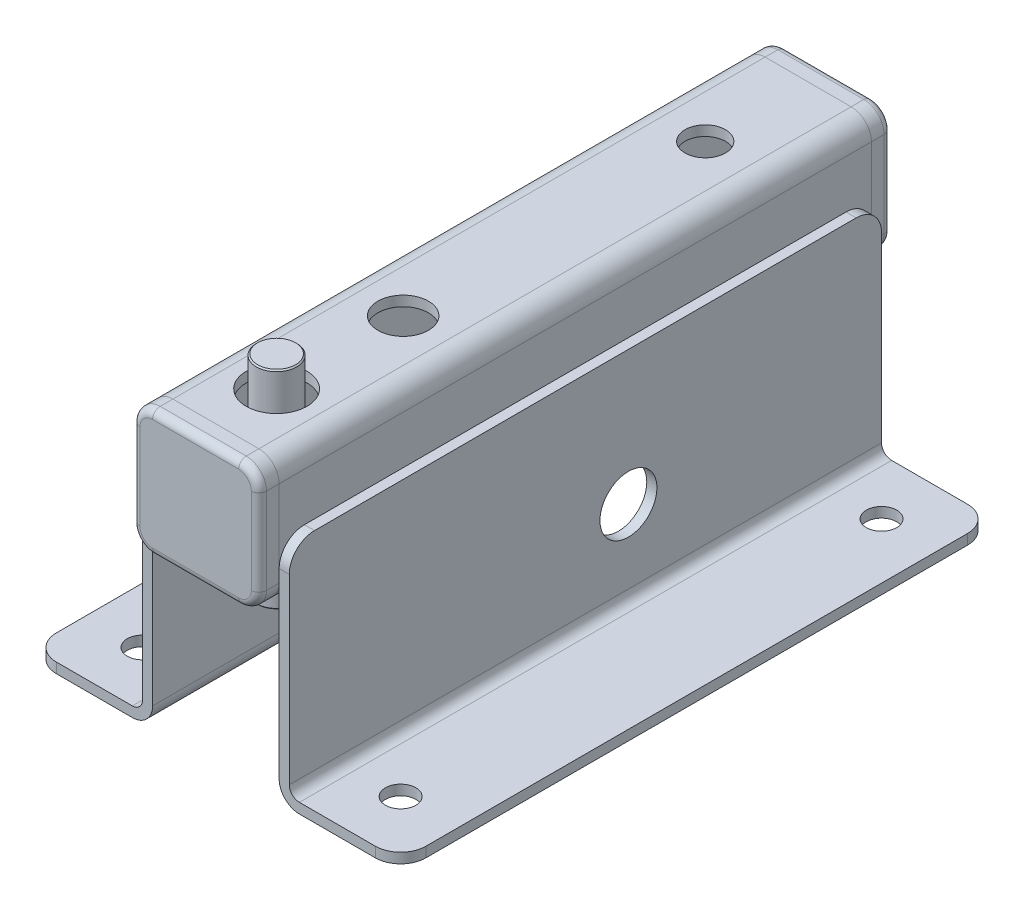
SolidWorks part; units mm, degrees
ref_plane "Plan de face" through (0, 0, 0) normal (0, 0, 1) x (1, 0, 0)
ref_plane "Plan de dessus" through (0, 0, 0) normal (0, 1, 0) x (1, 0, 0)
ref_plane "Plan de droite" through (0, 0, 0) normal (1, 0, 0) x (0, 0, -1)
sketch "Esquisse1" plane through (0, 0, 0) normal (0, 0, 1) x (1, 0, 0)
  line L0 (0, 12.5) -> (0, 0) construction
  line L1 (-8.5, 12.5) -> (8.5, 12.5)
  line L2 (-12.5, 8.5) -> (-12.5, -8.5)
  line L3 (-8.5, -12.5) -> (8.5, -12.5)
  line L4 (12.5, 8.5) -> (12.5, -8.5)
  line L5 (0, 0) -> (12.5, 0) construction
  line L6 (-8.5, 10.5) -> (8.5, 10.5)
  line L7 (10.5, 8.5) -> (10.5, -8.5)
  line L8 (-8.5, -10.5) -> (8.5, -10.5)
  line L9 (-10.5, 8.5) -> (-10.5, -8.5)
  arc A0 (-8.5, 12.5) -> (-12.5, 8.5) centre (-8.5, 8.5) ccw
  arc A1 (-12.5, -8.5) -> (-8.5, -12.5) centre (-8.5, -8.5) ccw
  arc A2 (8.5, -12.5) -> (12.5, -8.5) centre (8.5, -8.5) ccw
  arc A3 (8.5, 12.5) -> (12.5, 8.5) centre (8.5, 8.5) cw
  arc A4 (8.5, 10.5) -> (10.5, 8.5) centre (8.5, 8.5) cw
  arc A5 (8.5, -10.5) -> (10.5, -8.5) centre (8.5, -8.5) ccw
  arc A6 (-10.5, -8.5) -> (-8.5, -10.5) centre (-8.5, -8.5) ccw
  arc A7 (-8.5, 10.5) -> (-10.5, 8.5) centre (-8.5, 8.5) ccw
  dimension "D1" = 4
  dimension "D2" = 25
  dimension "D3" = 2
extrude "Boss.-Extru.1" add sketch "Esquisse1" against normal blind 117
sketch "Esquisse2" plane through (0, 0, 0) normal (0, 0, 1) x (1, 0, 0)
  line L0 (12.5, -1) -> (14.5, -1)
  line L1 (12.5, -8.5) -> (12.5, 8.5) construction
  line L2 (14.5, -1) -> (14.5, -42)
  line L3 (16.5, -44) -> (36.5, -44)
  line L4 (36.5, -44) -> (36.5, -46)
  line L5 (36.5, -46) -> (16.5, -46)
  line L6 (12.5, -42) -> (12.5, -1)
  line L7 (-8.5, -12.5) -> (8.5, -12.5) construction
  line L8 (0, 0) -> (0, -19.0193) construction
  line L9 (-12.5, -42) -> (-12.5, -1)
  line L10 (-36.5, -46) -> (-16.5, -46)
  line L11 (-36.5, -44) -> (-36.5, -46)
  line L12 (-16.5, -44) -> (-36.5, -44)
  line L13 (-14.5, -1) -> (-14.5, -42)
  line L14 (-12.5, -1) -> (-14.5, -1)
  arc A0 (16.5, -46) -> (12.5, -42) centre (16.5, -42) cw
  arc A1 (14.5, -42) -> (16.5, -44) centre (16.5, -42) ccw
  arc A2 (-14.5, -42) -> (-16.5, -44) centre (-16.5, -42) cw
  arc A3 (-16.5, -46) -> (-12.5, -42) centre (-16.5, -42) ccw
  dimension "D1" = 4
  dimension "D2" = 2
  dimension "D3" = 24
  dimension "D4" = 45
  dimension "D5" = 33.5
extrude "Boss.-Extru.2" add sketch "Esquisse2" against normal up to vertex (117 mm away) separate body
sketch "Esquisse3" plane through (0, 12.5, 0) normal (0, 1, 0) x (1, 0, 0)
  line L0 (8.5, 0) -> (-8.5, 0) construction
  line L1 (0, 12) -> (0, 0) construction
  circle A0 centre (0, 12) radius 6
  dimension "D1" = 12
  dimension "D2" = 12
extrude "Enlèv. mat.-Extru.1" cut sketch "Esquisse3" against normal blind 25
sketch "Esquisse6" plane through (0, 0, 0) normal (1, 0, 0) x (0, 0, -1)
  line L1 (18, 12.5) -> (6, 12.5) construction
  line L3 (12, 12.5) -> (12, -50.0553) construction
  line L4 (12, -8.5) -> (8.825, -10.3331)
  line L5 (8.825, -10.3331) -> (8.825, -22.25)
  line L6 (8.575, -22.5) -> (8.25, -22.5)
  line L7 (8, 18.25) -> (8, -22.25)
  line L8 (8.25, 18.5) -> (12, 18.5)
  line L9 (8, 18.25) -> (8.25, 18.5)
  line L10 (8.25, -22.5) -> (8, -22.25)
  line L11 (12, 18.5) -> (12, -8.5)
  line L12 (8.825, -22.25) -> (8.575, -22.5)
  line L14 (117, 12.5) -> (0, 12.5) construction
  point P6 (8, -22.5)
  point P9 (8.825, -22.5)
  point P10 (8, 18.5)
  dimension "D1" = 4
  dimension "D2" = 3.175
  dimension "D9" = 6
  dimension "D3" = 60
  dimension "D4" = 14
  dimension "D5" = 22.5
revolve "Révolution2" add sketch "Esquisse6" angle 360 about L11
sketch "Esquisse8" plane through (0, 12.5, 0) normal (0, 1, 0) x (1, 0, 0)
  line L0 (0, -18) -> (31.5768, -46.4319) construction
  line L1 (9, -53) -> (0, -53) construction
  line L2 (0, 12) -> (0, -18) construction
  line L3 (0, -18) -> (0, -53) construction
  line L4 (0, -18) -> (20.7783, 3.2338) construction
  line L5 (0, -18) -> (17.4005, -31.5948) construction
  line L6 (0, -53) -> (0, 96.6767) construction
  line L7 (0, 96.6767) -> (43.3333, -36.4481) construction
  line L8 (0, 12) -> (20, -10.3607) construction
  line L9 (0, 12) -> (43.3333, -36.4481) construction
  line L10 (36.5, 0) -> (16.5, 0) construction
  arc A0 (8.6984, 3.7333) -> (-11.9512, 13.0813) centre (0, 12) ccw
  circle A1 centre (0, -18) radius 3
  arc A2 (-8.8518, -54.6265) -> (9, -53) centre (0, -53) ccw
  circle A3 centre (0, -53) radius 4
  circle A4 centre (0, 12) radius 4 construction
  circle A5 centre (0, 12) radius 4
  arc A6 (7.9545, -24.0601) -> (7.9076, -11.8788) centre (0, -18) ccw
  arc A7 (8.6984, 3.7333) -> (7.9076, -11.8788) centre (17.3968, -4.5333) ccw
  arc A8 (7.9545, -24.0601) -> (6.1103, -35.1104) centre (17.5, -31.3323) ccw
  arc A9 (-11.9512, 13.0813) -> (-8.8518, -54.6265) centre (237.0318, -9.4462) ccw
  arc A10 (9, -53) -> (6.1103, -35.1104) centre (-47.8199, -53) ccw
  dimension "D3" = 8
  dimension "D4" = 6
  dimension "D5" = 9
  dimension "D6" = 12
  dimension "D7" = 20
  dimension "D10" = 12
  dimension "D13" = 500
  dimension "D1" = 30
  dimension "D2" = 65
  dimension "D8" = 140
  dimension "D9" = 17.5
  dimension "D11" = 128
  dimension "D12" = 42
  dimension "D15" = 65
  dimension "D16" = 20
sketch "Esquisse9" plane through (0, -22.5, 0) normal (0, -1, 0) x (1, 0, 0)
  line L1 (-4.7073, -11.6) -> (5.0575, -11.6)
  line L2 (-4.7073, -11.6) -> (-4.7073, -12.4)
  line L3 (-4.7073, -12.4) -> (5.0575, -12.4)
  line L4 (5.0575, -11.6) -> (5.0575, -12.4)
  circle A0 centre (0, -12) radius 3.425 construction
  dimension "D1" = 0.4
  dimension "D2" = 0.8
extrude "Enlèv. mat.-Extru.3" cut sketch "Esquisse9" against normal blind 10
sketch "Esquisse10" plane through (0, -44, 0) normal (0, 1, 0) x (1, 0, 0)
  line L0 (36.5, 117) -> (36.5, 0) construction
  line L1 (-25.5, 106) -> (25.5, 106) construction
  line L2 (-25.5, 106) -> (-25.5, 11) construction
  line L3 (-25.5, 11) -> (25.5, 11) construction
  line L4 (25.5, 106) -> (25.5, 11) construction
  line L5 (-36.5, 117) -> (-36.5, 0) construction
  line L6 (36.5, 0) -> (16.5, 0) construction
  line L7 (36.5, 117) -> (16.5, 117) construction
  circle A0 centre (25.5, 106) radius 3
  circle A1 centre (25.5, 11) radius 3
  circle A2 centre (-25.5, 106) radius 3
  circle A3 centre (-25.5, 11) radius 3
  dimension "D5" = 6
  dimension "D1" = 11
  dimension "D2" = 11
  dimension "D3" = 11
  dimension "D4" = 11
extrude "Enlèv. mat.-Extru.4" cut sketch "Esquisse10" against normal blind 2
sketch "Esquisse11" plane through (0, 12.5, 0) normal (0, 1, 0) x (1, 0, 0)
  line L1 (0, 96.6767) -> (0, 12) construction
  line L2 (0, 0) -> (0, 12) construction
  circle A0 centre (0, 96.6767) radius 4
  circle A2 centre (0, 37) radius 5
  dimension "D2" = 8
  dimension "D3" = 10
  dimension "D4" = 25
extrude "Enlèv. mat.-Extru.5" cut sketch "Esquisse11" against normal blind 2
sketch "Esquisse12" plane through (0, -10.5, 0) normal (0, 1, 0) x (1, 0, 0)
  circle A0 centre (0, 37) radius 2.25
  circle A2 centre (0, 37) radius 5 construction
  dimension "D1" = 4.5
extrude "Enlèv. mat.-Extru.6" cut sketch "Esquisse12" against normal blind 2
fillet "Congé2" radius 5 2 edges at (36.5, -45, -117) (36.5, -45, 0)
fillet "Congé3" radius 5 2 edges at (-36.5, -45, -117) (-36.5, -45, 0)
sketch "Esquisse14" plane through (0, 0, 0) normal (0, 0, 1) x (1, 0, 0)
  line L4 (-12.5, 8.5) -> (-12.5, -8.5)
  line L5 (-8.5, -12.5) -> (8.5, -12.5)
  line L6 (12.5, -8.5) -> (12.5, 8.5)
  line L7 (8.5, 12.5) -> (-8.5, 12.5)
  line L8 (-12.5, 8.5) -> (-12.5, -8.5)
  line L9 (-8.5, -12.5) -> (8.5, -12.5)
  line L10 (12.5, -8.5) -> (12.5, 8.5)
  line L11 (8.5, 12.5) -> (-8.5, 12.5)
  arc A4 (-8.5, 12.5) -> (-12.5, 8.5) centre (-8.5, 8.5) ccw
  arc A5 (-12.5, -8.5) -> (-8.5, -12.5) centre (-8.5, -8.5) ccw
  arc A6 (8.5, -12.5) -> (12.5, -8.5) centre (8.5, -8.5) ccw
  arc A7 (12.5, 8.5) -> (8.5, 12.5) centre (8.5, 8.5) ccw
  arc A8 (-8.5, 12.5) -> (-12.5, 8.5) centre (-8.5, 8.5) ccw
  arc A9 (-12.5, -8.5) -> (-8.5, -12.5) centre (-8.5, -8.5) ccw
  arc A10 (8.5, -12.5) -> (12.5, -8.5) centre (8.5, -8.5) ccw
  arc A11 (12.5, 8.5) -> (8.5, 12.5) centre (8.5, 8.5) ccw
  dimension "D1" = 0
extrude "Boss.-Extru.5" add sketch "Esquisse14" along normal blind 4 separate body
fillet "Congé4" radius 1.5 8 edges at (11.3284, -11.3284, 4) (0, -12.5, 4) (-11.3284, -11.3284, 4) (-12.5, 0, 4) (-11.3284, 11.3284, 4) (0, 12.5, 4) (11.3284, 11.3284, 4) (12.5, 0, 4)
sketch "Esquisse16" plane through (0, 0, -117) normal (0, 0, -1) x (-1, 0, 0)
  line L4 (8.5, 12.5) -> (-8.5, 12.5)
  line L5 (-12.5, 8.5) -> (-12.5, -8.5)
  line L6 (-8.5, -12.5) -> (8.5, -12.5)
  line L7 (12.5, -8.5) -> (12.5, 8.5)
  line L8 (8.5, 12.5) -> (-8.5, 12.5)
  line L9 (-12.5, 8.5) -> (-12.5, -8.5)
  line L10 (-8.5, -12.5) -> (8.5, -12.5)
  line L11 (12.5, -8.5) -> (12.5, 8.5)
  arc A4 (12.5, 8.5) -> (8.5, 12.5) centre (8.5, 8.5) ccw
  arc A5 (-8.5, 12.5) -> (-12.5, 8.5) centre (-8.5, 8.5) ccw
  arc A6 (-12.5, -8.5) -> (-8.5, -12.5) centre (-8.5, -8.5) ccw
  arc A7 (8.5, -12.5) -> (12.5, -8.5) centre (8.5, -8.5) ccw
  arc A8 (12.5, 8.5) -> (8.5, 12.5) centre (8.5, 8.5) ccw
  arc A9 (-8.5, 12.5) -> (-12.5, 8.5) centre (-8.5, 8.5) ccw
  arc A10 (-12.5, -8.5) -> (-8.5, -12.5) centre (-8.5, -8.5) ccw
  arc A11 (8.5, -12.5) -> (12.5, -8.5) centre (8.5, -8.5) ccw
  dimension "D1" = 0
extrude "Boss.-Extru.6" add sketch "Esquisse16" along normal blind 4 separate body
fillet "Congé7" radius 1.5 8 edges at (11.3284, 11.3284, -121) (0, 12.5, -121) (-11.3284, 11.3284, -121) (-12.5, 0, -121) (-11.3284, -11.3284, -121) (0, -12.5, -121) (11.3284, -11.3284, -121) (12.5, 0, -121)
sketch "Esquisse17" plane through (14.5, 0, 0) normal (1, 0, 0) x (0, 0, -1)
  line L0 (117, -42) -> (117, -1) construction
  line L1 (119.5, -12.5) -> (117, -12.5) construction
  circle A0 centre (67, -27.5) radius 5.625
  point P4 (118.25, -12.5)
  dimension "D1" = 11.25
  dimension "D3" = 15
  dimension "D2" = 50
extrude "Enlèv. mat.-Extru.7" cut sketch "Esquisse17" against normal blind 10
sketch "Esquisse18" plane through (-14.5, 0, 0) normal (-1, 0, 0) x (0, 0, 1)
  line L0 (0, -1) -> (0, -42) construction
  line L1 (-117, -12.5) -> (0, -12.5) construction
  circle A0 centre (-50, -27.5) radius 5.625
  dimension "D1" = 11.25
  dimension "D3" = 15
  dimension "D2" = 50
extrude "Enlèv. mat.-Extru.8" cut sketch "Esquisse18" against normal blind 10
fillet "Congé8" radius 5 2 edges at (13.5, -1, -117) (13.5, -1, 0)
fillet "Congé9" radius 5 2 edges at (-13.5, -1, -117) (-13.5, -1, 0)
